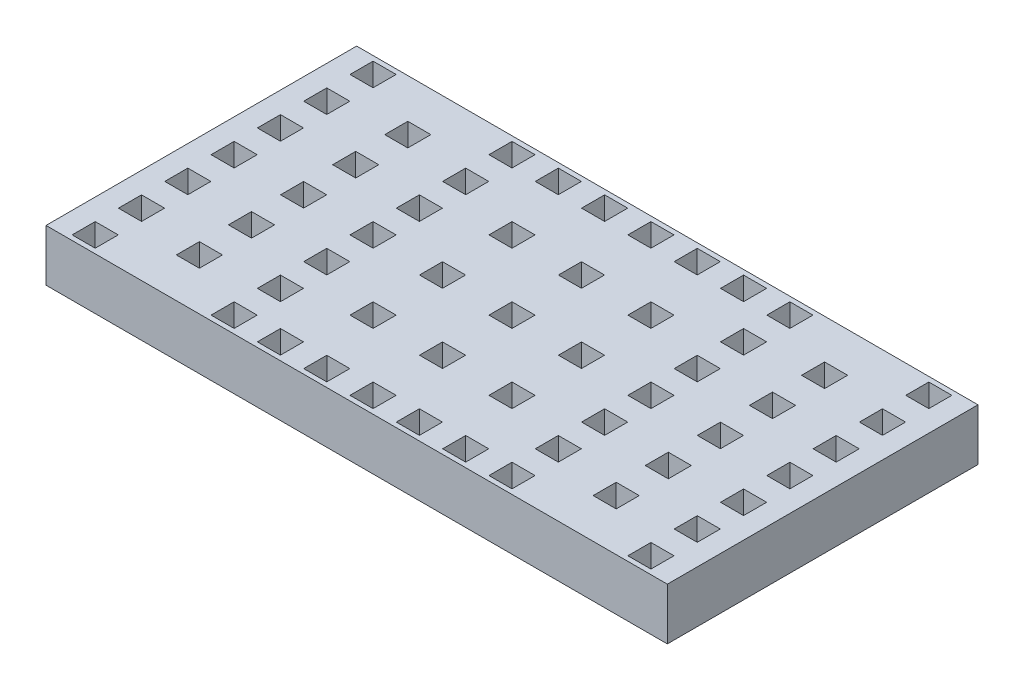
SolidWorks part; units mm, degrees
ref_plane "Front Plane" through (0, 0, 0) normal (0, 0, 1) x (1, 0, 0)
ref_plane "Top Plane" through (0, 0, 0) normal (0, 1, 0) x (1, 0, 0)
ref_plane "Right Plane" through (0, 0, 0) normal (1, 0, 0) x (0, 0, -1)
sketch "Sketch1" plane through (0, 0, 0) normal (0, 1, 0) x (1, 0, 0)
  line L1 (-76.2, 25.4) -> (76.2, 25.4)
  line L2 (-76.2, 25.4) -> (-76.2, -50.8)
  line L3 (-76.2, -50.8) -> (76.2, -50.8)
  line L4 (76.2, 25.4) -> (76.2, -50.8)
  dimension "D1" = 152.4
  dimension "D2" = 76.2
  dimension "D3" = 76.2
  dimension "D4" = 50.8
extrude "Extrude1" add sketch "Sketch1" along normal blind 12.7
other "Fill Pattern3" parameters "D8"=5.6569, "D5"=0, "D6"=0, "D4"=17.0388, "D9"=57, "D3"=0
